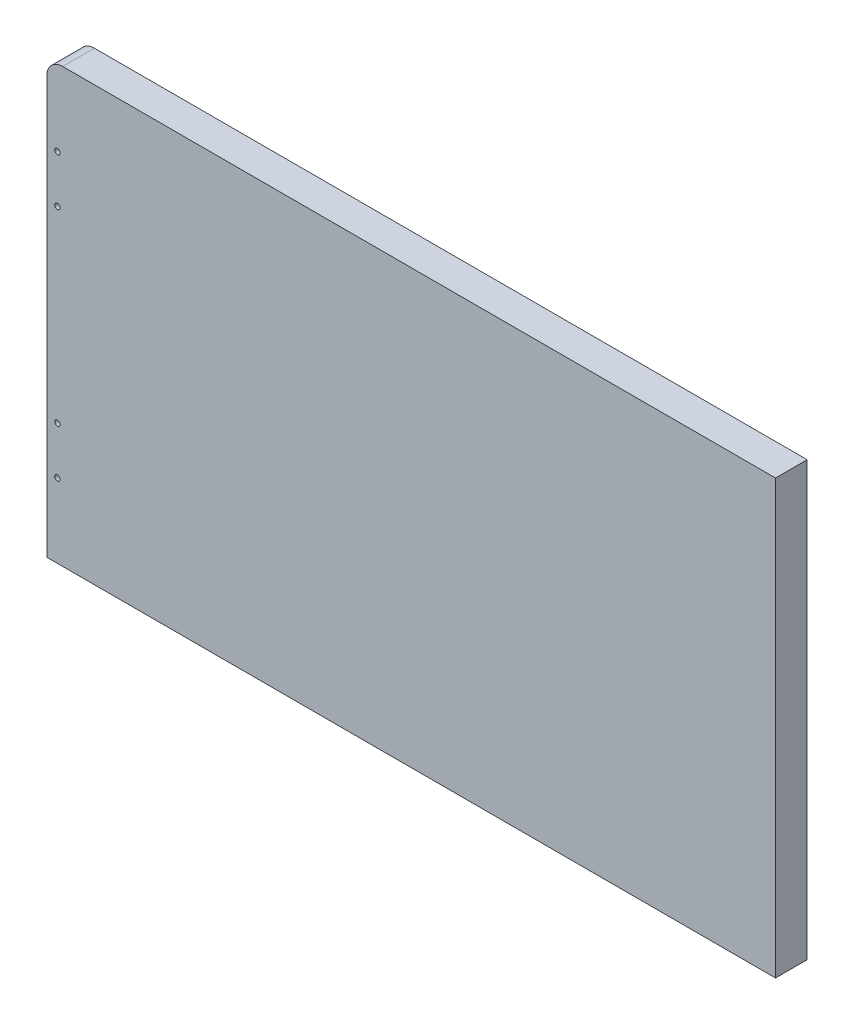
SolidWorks part; units mm, degrees
ref_plane "Front Plane" through (0, 0, 0) normal (0, 0, 1) x (1, 0, 0)
ref_plane "Top Plane" through (0, 0, 0) normal (0, 1, 0) x (1, 0, 0)
ref_plane "Right Plane" through (0, 0, 0) normal (1, 0, 0) x (0, 0, -1)
sketch "Sketch1" plane through (0, 0, 0) normal (0, 0, 1) x (1, 0, 0)
  line L1 (-690, 410) -> (690, 410)
  line L2 (-690, 410) -> (-690, -410)
  line L3 (-690, -410) -> (690, -410)
  line L4 (690, 410) -> (690, -410)
  line L5 (-690, 410) -> (690, -410) construction
  line L6 (-690, -410) -> (690, 410) construction
  point P0 (0, 0)
  dimension "D1" = 820
  dimension "D2" = 1380
extrude "Boss-Extrude1" add sketch "Sketch1" along normal blind 60
fillet "Fillet2" radius 30 1 edges at (-690, 410, 30)
sketch "Sketch2" plane through (0, 0, 60) normal (0, 0, 1) x (1, 0, 0)
  line L0 (-690, 380) -> (-690, -410) construction
  line L2 (690, 410) -> (-660, 410) construction
  line L3 (-690, -410) -> (690, -410) construction
  circle A0 centre (-670, 265.4408) radius 5
  circle A1 centre (-670, 175.3176) radius 5
  circle A2 centre (-670, -270) radius 5
  circle A3 centre (-669.9309, -180) radius 5
  dimension "D1" = 20
  dimension "D2" = 10
  dimension "D3" = 90.1231
  dimension "D4" = 10
  dimension "D5" = 10
  dimension "D6" = 90
  dimension "D7" = 20
  dimension "D8" = 144.5592
  dimension "D9" = 140
extrude "Cut-Extrude1" cut sketch "Sketch2" against normal blind 10
